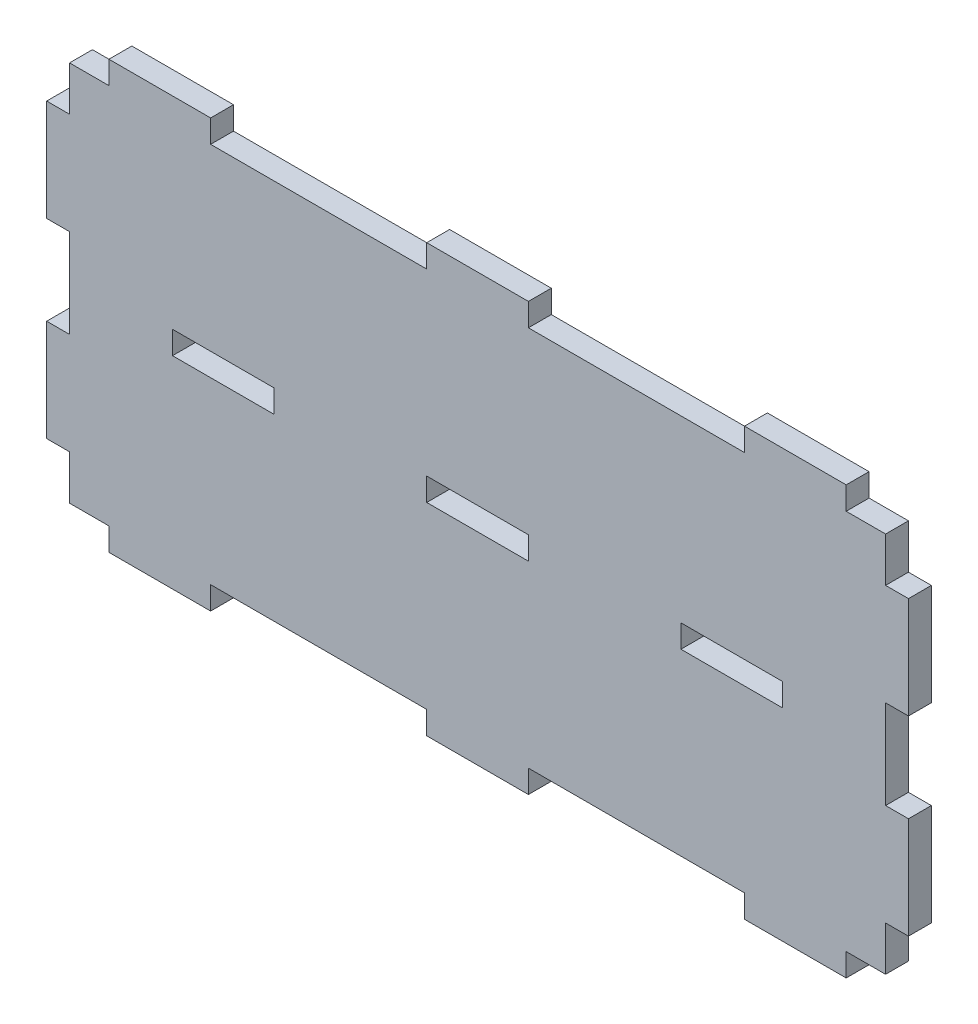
SolidWorks part; units mm, degrees
ref_plane "Piano frontale" through (0, 0, 0) normal (0, 0, 1) x (1, 0, 0)
ref_plane "Piano superiore" through (0, 0, 0) normal (0, 1, 0) x (1, 0, 0)
ref_plane "Piano destro" through (0, 0, 0) normal (1, 0, 0) x (0, 0, -1)
sketch "Schizzo1" plane through (0, 0, 0) normal (0, 0, 1) x (1, 0, 0)
  line L1 (-321, 150) -> (321, 150)
  line L2 (-321, 150) -> (-321, -150)
  line L3 (-321, -150) -> (321, -150)
  line L4 (321, 150) -> (321, -150)
  line L5 (-321, 150) -> (321, -150) construction
  line L6 (-321, -150) -> (321, 150) construction
  point P0 (0, 0)
  dimension "D1" = 300
  dimension "D2" = 642
extrude "Estrusione-Estrusione1" add sketch "Schizzo1" along normal blind 18
sketch "Schizzo2" plane through (0, 0, 18) normal (0, 0, 1) x (1, 0, 0)
  line L0 (-321, -159) -> (321, -159) construction
  line L1 (321, -150) -> (321, 150) construction
  line L2 (-321, 150) -> (-321, -150) construction
  line L3 (-321, -150) -> (321, -150) construction
  line L4 (0, 0) -> (0, -150) construction
  line L5 (-290, -168) -> (-210, -168)
  line L6 (-290, -168) -> (-290, -150)
  line L7 (-290, -150) -> (-210, -150)
  line L8 (-210, -168) -> (-210, -150)
  line L9 (-290, -168) -> (-210, -150) construction
  line L10 (-290, -150) -> (-210, -168) construction
  line L11 (290, -150) -> (210, -168) construction
  line L12 (290, -168) -> (210, -150) construction
  line L13 (210, -168) -> (210, -150)
  line L14 (290, -150) -> (210, -150)
  line L15 (290, -168) -> (290, -150)
  line L16 (290, -168) -> (210, -168)
  line L17 (-321, 0) -> (321, 0) construction
  line L18 (-40, -168) -> (40, -168)
  line L19 (-40, -168) -> (-40, -150)
  line L20 (-40, -150) -> (40, -150)
  line L21 (40, -168) -> (40, -150)
  line L22 (-40, -168) -> (40, -150) construction
  line L23 (-40, -150) -> (40, -168) construction
  line L24 (-40, 150) -> (40, 168) construction
  line L25 (-40, 168) -> (40, 150) construction
  line L26 (290, 168) -> (210, 150) construction
  line L27 (290, 150) -> (210, 168) construction
  line L28 (-290, 150) -> (-210, 168) construction
  line L29 (-290, 168) -> (-210, 150) construction
  line L30 (-321, 159) -> (321, 159) construction
  line L31 (40, 168) -> (40, 150)
  line L32 (-40, 150) -> (40, 150)
  line L33 (-40, 168) -> (-40, 150)
  line L34 (-40, 168) -> (40, 168)
  line L35 (290, 168) -> (210, 168)
  line L36 (290, 168) -> (290, 150)
  line L37 (290, 150) -> (210, 150)
  line L38 (210, 168) -> (210, 150)
  line L39 (-210, 168) -> (-210, 150)
  line L40 (-290, 150) -> (-210, 150)
  line L41 (-290, 168) -> (-290, 150)
  line L42 (-290, 168) -> (-210, 168)
  point P10 (-250, -159)
  point P20 (250, -159)
  point P21 (0, -159)
  point P42 (0, 159)
  point P43 (250, 159)
  point P44 (-250, 159)
  dimension "D1" = 9
  dimension "D2" = 31
  dimension "D3" = 80
  dimension "D4" = 80
extrude "Estrusione-Estrusione2" add sketch "Schizzo2" against normal blind 18
sketch "Schizzo3" plane through (0, 0, 18) normal (0, 0, 1) x (1, 0, 0)
  line L0 (-330, 150) -> (-330, -150) construction
  line L1 (-321, -150) -> (-290, -150) construction
  line L2 (-290, 150) -> (-321, 150) construction
  line L3 (-321, 150) -> (-321, -150) construction
  line L4 (0, 168) -> (0, -168) construction
  line L5 (40, 168) -> (-40, 168) construction
  line L6 (-40, -168) -> (40, -168) construction
  line L7 (-330, 0) -> (330, 0) construction
  line L8 (-339, 115) -> (-321, 115)
  line L9 (-339, 115) -> (-339, 35)
  line L10 (-339, 35) -> (-321, 35)
  line L11 (-321, 115) -> (-321, 35)
  line L12 (-339, 115) -> (-321, 35) construction
  line L13 (-339, 35) -> (-321, 115) construction
  line L14 (-339, -35) -> (-321, -115) construction
  line L15 (-339, -115) -> (-321, -35) construction
  line L16 (-321, -115) -> (-321, -35)
  line L17 (-339, -35) -> (-321, -35)
  line L18 (-339, -115) -> (-339, -35)
  line L19 (-339, -115) -> (-321, -115)
  line L20 (339, -115) -> (321, -35) construction
  line L21 (339, -35) -> (321, -115) construction
  line L22 (339, 35) -> (321, 115) construction
  line L23 (339, 115) -> (321, 35) construction
  line L24 (330, 150) -> (330, -150) construction
  line L25 (339, -115) -> (321, -115)
  line L26 (339, -115) -> (339, -35)
  line L27 (339, -35) -> (321, -35)
  line L28 (321, -115) -> (321, -35)
  line L29 (321, 115) -> (321, 35)
  line L30 (339, 35) -> (321, 35)
  line L31 (339, 115) -> (339, 35)
  line L32 (339, 115) -> (321, 115)
  point P2 (-330, 75)
  point P26 (-330, -75)
  point P37 (330, -75)
  point P38 (330, 75)
  dimension "D1" = 9
  dimension "D2" = 80
  dimension "D3" = 75
extrude "Estrusione-Estrusione3" add sketch "Schizzo3" against normal blind 18
sketch "Schizzo4" plane through (0, 0, 18) normal (0, 0, 1) x (1, 0, 0)
  line L0 (-321, 0) -> (321, 0) construction
  line L1 (-321, 35) -> (-321, -35) construction
  line L2 (321, -35) -> (321, 35) construction
  line L3 (0, 168) -> (0, -168) construction
  line L4 (-40, 9) -> (40, 9)
  line L5 (-40, 9) -> (-40, -9)
  line L6 (-40, -9) -> (40, -9)
  line L7 (40, 9) -> (40, -9)
  line L8 (-40, 9) -> (40, -9) construction
  line L9 (-40, -9) -> (40, 9) construction
  line L10 (-240, 9) -> (-160, 9)
  line L11 (-240, 9) -> (-240, -9)
  line L12 (-240, -9) -> (-160, -9)
  line L13 (-160, 9) -> (-160, -9)
  line L14 (-240, 9) -> (-160, -9) construction
  line L15 (-240, -9) -> (-160, 9) construction
  line L16 (40, 168) -> (-40, 168) construction
  line L17 (-40, -168) -> (40, -168) construction
  line L18 (240, -9) -> (160, 9) construction
  line L19 (240, 9) -> (160, -9) construction
  line L20 (160, 9) -> (160, -9)
  line L21 (240, -9) -> (160, -9)
  line L22 (240, 9) -> (240, -9)
  line L23 (240, 9) -> (160, 9)
  point P6 (0, 0)
  point P12 (-200, 0)
  point P27 (200, 0)
  dimension "D1" = 80
  dimension "D2" = 18
  dimension "D3" = 200
extrude "Taglio-Estrusione1" cut sketch "Schizzo4" against normal through all
